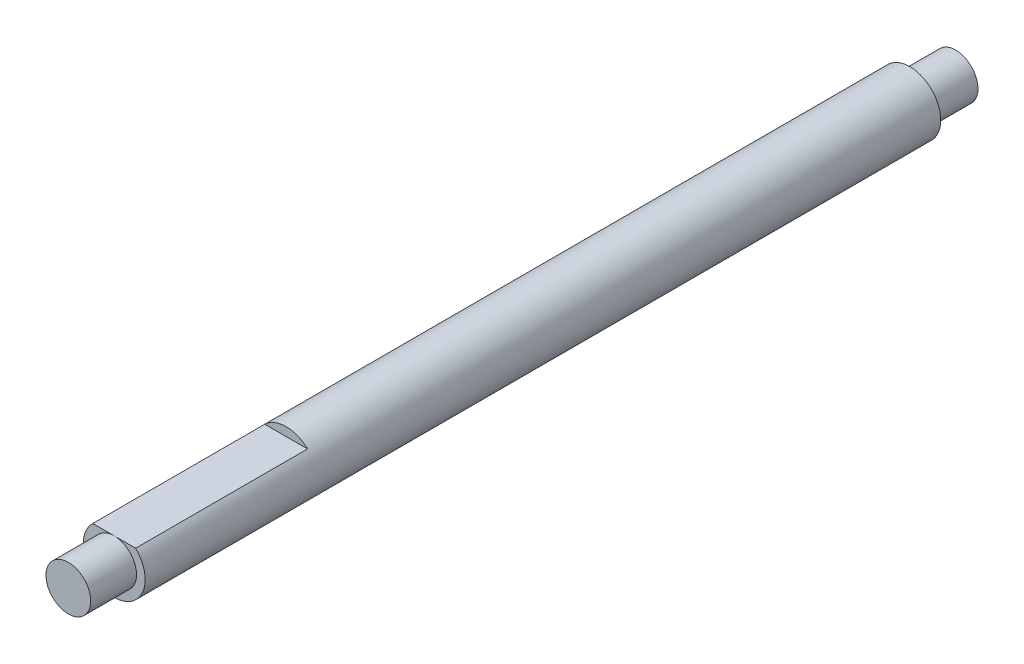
SolidWorks part; units mm, degrees
ref_plane "Plano frontal" through (0, 0, 0) normal (0, 0, 1) x (1, 0, 0)
ref_plane "Plano superior" through (0, 0, 0) normal (0, 1, 0) x (1, 0, 0)
ref_plane "Plano direito" through (0, 0, 0) normal (1, 0, 0) x (0, 0, -1)
sketch "Esboço1" plane through (0, 0, 0) normal (0, 0, 1) x (1, 0, 0)
  circle A0 centre (0, 0) radius 2.7
  dimension "D1" = 5.4
extrude "Ressalto-extrusão1" add sketch "Esboço1" along normal blind 69.4
sketch "Esboço2" plane through (0, 0, 69.4) normal (0, 0, 1) x (1, 0, 0)
  circle A0 centre (0, 0) radius 1.95
  dimension "D1" = 3.9
extrude "Ressalto-extrusão2" add sketch "Esboço2" along normal blind 4
sketch "Esboço3" plane through (0, 0, 0) normal (0, 0, -1) x (-1, 0, 0)
  circle A0 centre (0, 0) radius 1.95
  dimension "D1" = 3.9
extrude "Ressalto-extrusão3" add sketch "Esboço3" along normal blind 4
sketch "Esboço4" plane through (0, 0, 69.4) normal (0, 0, 1) x (1, 0, 0)
  line L0 (0, 1.95) -> (0, 2.7) construction
  line L1 (-1.8675, 1.95) -> (1.8675, 1.95) construction
  line L2 (-1.8675, 1.95) -> (1.8675, 1.95)
  line L3 (1.8675, 1.95) -> (1.8675, 2.7)
  line L4 (1.8675, 2.7) -> (-1.8675, 2.7)
  line L5 (-1.8675, 2.7) -> (-1.8675, 1.95)
  circle A0 centre (0, 0) radius 1.95 construction
  circle A1 centre (0, 0) radius 1.95 construction
  circle A3 centre (0, 0) radius 2.7 construction
  circle A4 centre (0, 0) radius 2.7 construction
ref_plane "Plano1" through (0, 0, 69.4) normal (0, 0, 1) x (1, 0, 0)
sketch "Esboço5" plane through (0, 0, 69.4) normal (0, 0, 1) x (1, 0, 0)
  line L0 (-1.8675, 2.7) -> (-1.8675, 1.95) construction
  line L1 (1.8675, 2.7) -> (-1.8675, 2.7) construction
  line L2 (1.8675, 1.95) -> (1.8675, 2.7) construction
  line L3 (-1.8675, 1.95) -> (1.8675, 1.95) construction
  line L4 (-1.8675, 2.7) -> (-1.8675, 1.95)
  line L5 (1.8675, 2.7) -> (-1.8675, 2.7)
  line L6 (1.8675, 1.95) -> (1.8675, 2.7)
  line L7 (-1.8675, 1.95) -> (1.8675, 1.95)
extrude "Corte-extrusão2" cut sketch "Esboço5" against normal blind 15
